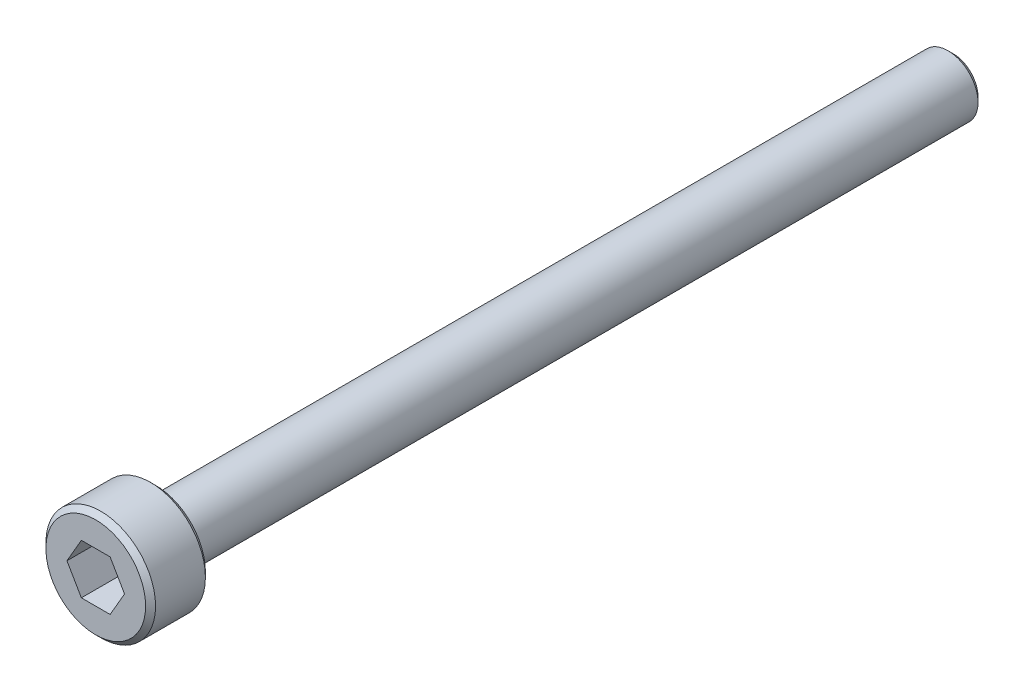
SolidWorks part; units mm, degrees
ref_plane "Front Plane" through (0, 0, 0) normal (1, 0, 0) x (0, 1, 0)
ref_plane "Top Plane" through (0, 0, 0) normal (0, 0, 1) x (0, 1, 0)
ref_plane "Right Plane" through (0, 0, 0) normal (0, 1, 0) x (-1, 0, 0)
sketch "Sketch1" plane through (0, 0, 0) normal (0, 0, 1) x (0, 1, 0)
  circle A0 centre (0, 0) radius 1.5
  dimension "D1" = 3
extrude "Boss-Extrude1" add sketch "Sketch1" along normal blind 40
sketch "Sketch2" plane through (0, 0, 40) normal (0, 0, 1) x (1, 0, 0)
  circle A0 centre (0, 0) radius 2.75
  dimension "D1" = 5.5
extrude "Boss-Extrude2" add sketch "Sketch2" along normal blind 3
chamfer "Chamfer1" distance 0.25 angle 45 3 edges at (2.75, 0, 40) (1.5, 0, 0) (2.75, 0, 43)
sketch "Sketch3" plane through (0, 0, 43) normal (0, 0, 1) x (1, 0, 0)
  line L1 (1.4434, 0) -> (0.7217, 1.25)
  line L2 (0.7217, 1.25) -> (-0.7217, 1.25)
  line L3 (-0.7217, 1.25) -> (-1.4434, 0)
  line L4 (-1.4434, 0) -> (-0.7217, -1.25)
  line L5 (-0.7217, -1.25) -> (0.7217, -1.25)
  line L6 (0.7217, -1.25) -> (1.4434, 0)
  circle A0 centre (0, 0) radius 1.25 construction
  dimension "D1" = 2.5
extrude "Cut-Extrude1" cut sketch "Sketch3" against normal blind 2
